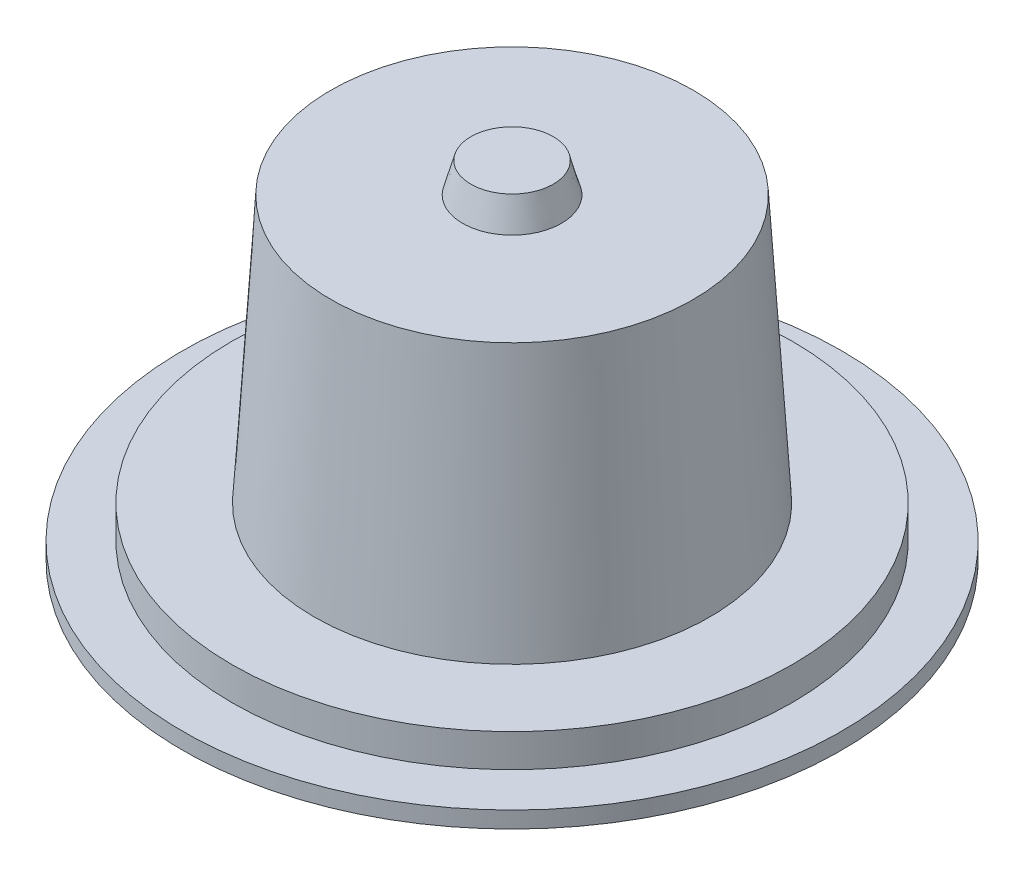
SolidWorks part; units mm, degrees
ref_plane "Alzado" through (0, 0, 0) normal (0, 0, 1) x (1, 0, 0)
ref_plane "Planta" through (0, 0, 0) normal (0, 1, 0) x (1, 0, 0)
ref_plane "Vista lateral" through (0, 0, 0) normal (1, 0, 0) x (0, 0, -1)
sketch "Croquis1" plane through (0, 0, 0) normal (0, 0, 1) x (1, 0, 0)
  line L0 (0, 0) -> (0, 110) construction
  line L1 (-50, 0) -> (-90, 0)
  line L2 (-90, 0) -> (-100, 5)
  line L4 (0, 5) -> (0, 0)
  line L5 (-100, 5) -> (-100, 10)
  line L6 (-100, 10) -> (-85, 10)
  line L7 (0, 10) -> (0, 5)
  line L8 (-100, 10) -> (-85, 10)
  line L9 (-85, 10) -> (-85, 20)
  line L10 (-85, 20) -> (-60, 20)
  line L11 (0, 20) -> (0, 10)
  line L12 (-85, 20) -> (-60, 20)
  line L13 (0, 110) -> (0, 100.9563)
  line L14 (-15, 100.9563) -> (-55, 100.9563)
  line L15 (-55, 100.9563) -> (-60, 20)
  line L17 (0, 110) -> (-12.5, 110)
  line L18 (-12.5, 110) -> (-15, 100.9563)
  line L19 (0, 100.9563) -> (0, 20)
  line L21 (-50, 0) -> (-50, 10)
  line L22 (-50, 10) -> (0, 10)
  dimension "D1" = 90
  dimension "D2" = 100
  dimension "D3" = 10
  dimension "D4" = 5
  dimension "D5" = 10
  dimension "D6" = 10
  dimension "D7" = 85
  dimension "D8" = 60
  dimension "D9" = 55
  dimension "D10" = 80.9563
  dimension "D11" = 12.5
  dimension "D12" = 50
revolve "Revolución1" add sketch "Croquis1" angle 360 about L0
